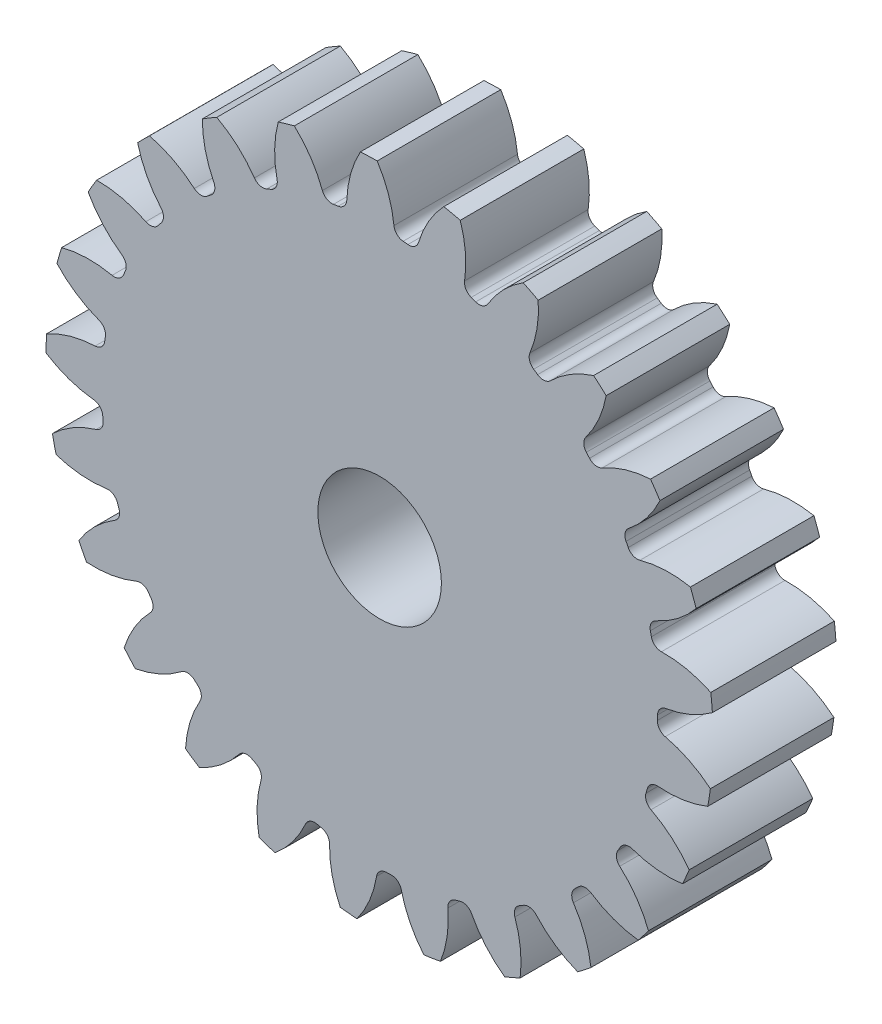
SolidWorks part; units mm, degrees
ref_plane "Front" through (0, 0, 0) normal (0, 0, 1) x (1, 0, 0)
ref_plane "Top" through (0, 0, 0) normal (0, 1, 0) x (1, 0, 0)
ref_plane "Right" through (0, 0, 0) normal (1, 0, 0) x (0, 0, -1)
sketch "Sketch3" plane through (0, 0, 0) normal (0, 0, 1) x (1, 0, 0)
  circle A0 centre (0, 0) radius 274.32
  dimension "od" = 548.64
extrude "gearBody" add sketch "Sketch3" along normal blind 101.6
sketch "Sketch2" plane through (0, 0, 0) normal (0, 0, 1) x (1, 0, 0)
  line L0 (0, 0) -> (220.5133, 91.3396) construction
  line L1 (272.6192, -36.3216) -> (0, 0) construction
  line L2 (0, 0) -> (36.3143, 0) construction
  line L3 (253.8675, 8.2045) -> (252.9028, -23.583) construction
  line L5 (253.3851, -7.6893) -> (0, 0) construction
  line L7 (0, 0) -> (238.6819, 0) construction
  arc A0 (238.6545, 3.6193) -> (237.9959, -18.0839) centre (0, 0) ccw construction
  arc A1 (273.6457, 19.2223) -> (271.9766, -35.7799) centre (0, 0) ccw construction
  arc A2 (253.8675, 8.2045) -> (252.9028, -23.583) centre (0, 0) ccw construction
  arc A3 (228.4264, -8.9071) -> (228.5462, -4.9603) centre (0, 0) ccw
  arc A4 (272.6192, -36.3216) -> (234.8206, -17.2855) centre (214.5691, -104.5427) ccw
  arc A5 (272.6192, -36.3216) -> (274.32, 19.724) centre (0, 0) ccw
  arc A6 (274.32, 19.724) -> (235.4367, 3.015) centre (220.5133, 91.3396) cw
  arc A7 (228.5462, -4.9603) -> (235.4367, 3.015) centre (236.8145, -5.1397) cw
  arc A8 (234.8206, -17.2855) -> (228.4264, -8.9071) centre (236.6904, -9.2294) cw
  point P6 (274.32, 19.724)
  point P22 (272.6192, -36.3216)
  dimension "baseDia" = 477.3639
  dimension "od" = 548.64
  dimension "pd" = 508
  dimension "rd" = 457.2
  dimension "rFillet" = 8.2702
  dimension "pointX" = 274.32
  dimension "pointY" = 19.724
  dimension "CTT" = 31.7875
  dimension "flankCenterAngle" = 22.5
extrude "toothCut" cut sketch "Sketch2" along normal through all
pattern_circular "CirPattern1" count 25 over 360 about axis through (0, 0, 0) along (0, 0, 1) of "toothCut"
sketch "hub1Dia" plane through (0, 0, 0) normal (0, 0, -1) x (-1, 0, 0)
  circle A0 centre (0, 0) radius 12.7
  dimension "hub1Dia" = 25.4
sketch "hub2Dia" plane through (0, 0, 101.6) normal (0, 0, 1) x (1, 0, 0)
  circle A0 centre (0, 0) radius 12.7
  dimension "hub2dia" = 25.4
sketch "boreDia" plane through (0, 0, 0) normal (0, 0, 1) x (1, 0, 0)
  circle A0 centre (0, 0) radius 50.8
  dimension "boreDia" = 101.6
extrude "bore" cut sketch "boreDia" against normal mid plane 25400
